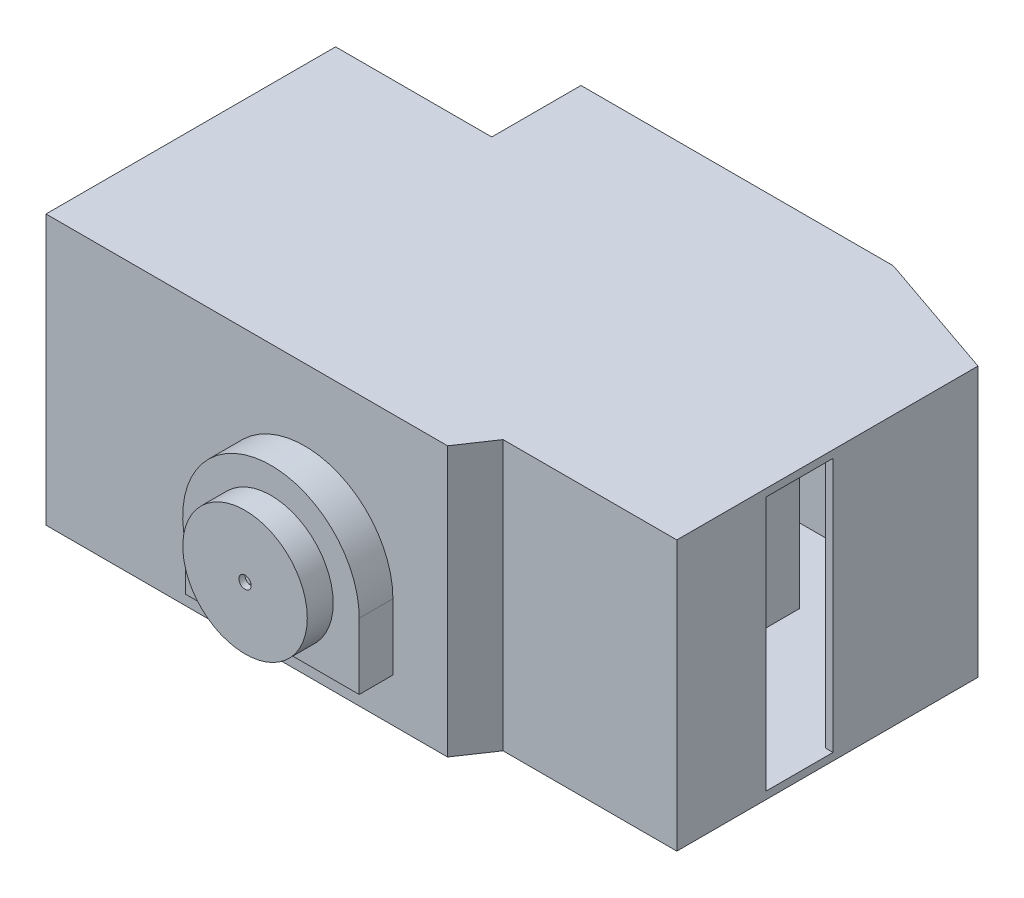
SolidWorks part; units mm, degrees
ref_plane "Front" through (0, 0, 0) normal (0, 0, 1) x (1, 0, 0)
ref_plane "Top" through (0, 0, 0) normal (0, 1, 0) x (1, 0, 0)
ref_plane "Right" through (0, 0, 0) normal (1, 0, 0) x (0, 0, -1)
sketch "Sketch1" plane through (0, 0, 0) normal (0, 1, 0) x (1, 0, 0)
  line L1 (101.6, 101.6) -> (101.6, 1524)
  line L2 (5486.4, 0) -> (5791.7752, 452.7374)
  line L3 (5791.7752, 452.7374) -> (8166.6752, 452.7374)
  line L4 (8166.6752, 452.7374) -> (8166.6752, 1671.9374)
  line L5 (8166.6752, 1671.9374) -> (8166.6752, 2586.3374) construction
  line L6 (8166.6752, 2586.3374) -> (8166.6752, 4567.5374)
  line L7 (8166.6752, 4567.5374) -> (6401.4866, 5175.3406)
  line L8 (6401.4866, 5175.3406) -> (5029.8866, 5175.3406)
  line L9 (5029.8866, 5175.3406) -> (3201.0866, 5175.3406) construction
  line L10 (3201.0866, 5175.3406) -> (2134.2866, 5175.3406)
  line L11 (2134.2866, 5175.3406) -> (2134.2866, 3956.1406)
  line L12 (2134.2866, 3956.1406) -> (0.6866, 3956.1406)
  line L13 (0.6866, 3956.1406) -> (0.6866, 2432.1406)
  line L14 (0, 0) -> (0, 1524)
  line L15 (0.6866, 2432.1406) -> (0, 1524) construction
  line L17 (5432.3783, 101.6) -> (5737.7536, 554.3374)
  line L18 (5737.7536, 554.3374) -> (6134.6752, 554.3374)
  line L19 (8065.0752, 554.3374) -> (8065.0752, 1671.9374)
  line L20 (3201.0866, 5073.7406) -> (2235.8866, 5073.7406)
  line L21 (2235.8866, 5073.7406) -> (2235.8866, 3854.5406)
  line L22 (2235.8866, 3854.5406) -> (102.2866, 3854.5406)
  line L23 (102.2866, 3854.5406) -> (102.2866, 2432.1406)
  line L24 (8065.0752, 2586.3374) -> (8065.0752, 4495.0668)
  line L25 (8065.0752, 4495.0668) -> (6384.4846, 5073.7406)
  line L26 (6384.4846, 5073.7406) -> (6236.2752, 5073.7406)
  line L27 (0.6866, 2432.1406) -> (102.2866, 2432.1406)
  line L28 (3201.0866, 5175.3406) -> (3201.0866, 5073.7406)
  line L29 (5029.8866, 5175.3406) -> (5029.8866, 5073.7406)
  line L30 (8166.6752, 2586.3374) -> (8065.0752, 2586.3374)
  line L31 (8166.6752, 1671.9374) -> (8065.0752, 1671.9374)
  line L32 (101.6, 1524) -> (0, 1524)
  line L33 (6236.2752, 554.3374) -> (6236.2752, 4059.5374)
  line L34 (6134.6752, 554.3374) -> (6134.6752, 4059.5374)
  line L35 (6236.2752, 4059.5374) -> (6134.6752, 4059.5374)
  line L36 (6236.2752, 554.3374) -> (8065.0752, 554.3374)
  line L37 (5737.7536, 554.3374) -> (8065.0752, 554.3374) construction
  line L38 (6236.2752, 4059.5374) -> (6236.2752, 4973.9374) construction
  line L39 (6236.2752, 4973.9374) -> (6236.2752, 5073.7406)
  line L40 (6134.6752, 4973.9374) -> (6134.6752, 5073.7406)
  line L41 (6134.6752, 4973.9374) -> (6236.2752, 4973.9374)
  line L42 (6134.6752, 5073.7406) -> (5029.8866, 5073.7406)
  line L43 (6384.4846, 5073.7406) -> (5029.8866, 5073.7406) construction
  line L46 (101.6, 101.6) -> (5432.3783, 101.6)
  line L47 (0, 0) -> (5486.4, 0)
  line L48 (101.6, 101.6) -> (5432.3783, 101.6) construction
  line L50 (0, 0) -> (5486.4, 0) construction
  dimension "D1" = 5486.4
  dimension "D3" = 2374.9
  dimension "D4" = 1219.2
  dimension "D5" = 914.4
  dimension "D6" = 1981.2
  dimension "D7" = 109
  dimension "D8" = 1866.9
  dimension "D9" = 1371.6
  dimension "D10" = 1828.8
  dimension "D11" = 1066.8
  dimension "D12" = 1219.2
  dimension "D13" = 2133.6
  dimension "D14" = 1524
  dimension "D15" = 1524
  dimension "D16" = 546.1
  dimension "D17" = 101.6
  dimension "D18" = 101.6
  dimension "D19" = 5330.7783
  dimension "D20" = 3505.2
  dimension "D21" = 1828.8
  dimension "D22" = 101.6
  dimension "D23" = 914.4
  dimension "D24" = 101.6
  dimension "D25" = 101.6
extrude "Extrude5" add sketch "Sketch1" along normal blind 3479.8
sketch "Sketch2" plane through (0, 3479.8, 0) normal (0, 1, 0) x (1, 0, 0)
  line L0 (0.6866, 3956.1406) -> (2134.2866, 3956.1406)
  line L1 (2134.2866, 3956.1406) -> (2134.2866, 5175.3406)
  line L2 (2134.2866, 5175.3406) -> (6401.4866, 5175.3406)
  line L3 (6401.4866, 5175.3406) -> (8166.6752, 4567.5374)
  line L4 (8166.6752, 4567.5374) -> (8166.6752, 452.7374)
  line L5 (8166.6752, 452.7374) -> (5791.7752, 452.7374)
  line L6 (5791.7752, 452.7374) -> (5486.4, 0)
  line L7 (5486.4, 0) -> (0, 0)
  line L8 (0, 0) -> (0.6866, 3956.1406)
extrude "Extrude6" add sketch "Sketch2" along normal blind 101.6
sketch "Sketch3" plane through (0, 0, 0) normal (0, -1, 0) x (1, 0, 0)
  line L2 (8166.6752, -452.7374) -> (5791.7752, -452.7374)
  line L3 (5791.7752, -452.7374) -> (5486.4, 0)
  line L4 (5486.4, 0) -> (0, 0)
  line L5 (0, 0) -> (0.6866, -3956.1406)
  line L6 (0.6866, -3956.1406) -> (2134.2866, -3956.1406)
  line L7 (2134.2866, -3956.1406) -> (2134.2866, -5175.3406)
  line L8 (2134.2866, -5175.3406) -> (6401.4866, -5175.3406)
  line L10 (6401.4866, -5175.3406) -> (8166.6752, -4567.5374)
  line L11 (8166.6752, -4567.5374) -> (8166.6752, -452.7374)
extrude "Extrude7" add sketch "Sketch3" along normal blind 101.6
sketch "Sketch4" plane through (0, 0, 0) normal (0, 0, 1) x (1, 0, 0)
  line L1 (3533.775, 2604.4) -> (2188.3802, 2604.4) construction
  line L3 (5486.4, -101.6) -> (0, -101.6) construction
  line L4 (0, 3479.8) -> (0, 0) construction
  line L5 (4739.775, 1398.4) -> (4739.775, 495.3)
  line L8 (2368.55, 495.3) -> (4739.775, 495.3)
  line L10 (2368.55, 1087.4552) -> (2368.55, 495.3)
  arc A2 (4739.775, 1398.4) -> (2368.55, 1087.4552) centre (3533.775, 1398.4) ccw
  dimension "D1" = 596.9
  dimension "D4" = 1500
  dimension "D6" = 1206
  dimension "D2" = 2368.55
  dimension "D3" = 3533.775
extrude "Extrude8" add sketch "Sketch4" along normal blind 460.0575
sketch "Sketch5" plane through (0, 0, 460.0575) normal (0, 0, 1) x (1, 0, 0)
  circle A0 centre (3533.775, 1398.4) radius 850.392
  dimension "D1" = 1700.784
extrude "Extrude9" add sketch "Sketch5" along normal blind 353.9998
sketch "Sketch6" plane through (0, 0, -101.6) normal (0, 0, -1) x (-1, 0, 0)
  line L0 (-4286.8089, 590.55) -> (-2780.7411, 590.55)
  line L1 (-5432.3783, 0) -> (-101.6, 0) construction
  arc A0 (-2368.55, 1087.4552) -> (-4739.775, 1398.4) centre (-3533.775, 1398.4) ccw construction
  arc A1 (-2368.55, 1087.4552) -> (-4739.775, 1398.4) centre (-3533.775, 1398.4) ccw construction
  arc A2 (-2780.7411, 590.55) -> (-4286.8089, 590.55) centre (-3533.775, 1398.4) ccw
  dimension "D1" = 2208.784
  dimension "D2" = 590.55
extrude "Extrude10" cut sketch "Sketch6" against normal blind 546.1
sketch "Sketch7" plane through (0, 0, 444.5) normal (0, 0, -1) x (-1, 0, 0)
  circle A1 centre (-3533.775, 1398.4) radius 748.792
  dimension "D1" = 1497.584
extrude "Extrude11" cut sketch "Sketch7" against normal blind 285.75
sketch "Sketch8" plane through (0, 0, 730.25) normal (0, 0, -1) x (-1, 0, 0)
  circle A0 centre (-3533.775, 1398.4) radius 84.1375
  dimension "D1" = 168.275
extrude "Extrude12" cut sketch "Sketch8" against normal through all
sketch "Sketch9" plane through (0, 0, 0) normal (0, 1, 0) x (1, 0, 0)
  line L0 (102.2866, 3854.5406) -> (2235.8866, 3854.5406) construction
  line L1 (5432.3783, 101.6) -> (101.6, 101.6) construction
  line L2 (102.2866, 3854.5406) -> (2235.8866, 3854.5406) construction
  line L3 (5432.3783, 101.6) -> (101.6, 101.6) construction
  line L4 (101.6, 101.6) -> (101.6, 1524) construction
  line L5 (1066.8, 101.6) -> (952.5, 101.6)
  line L6 (1066.8, 101.6) -> (1066.8, 3854.5406)
  line L7 (1066.8, 3854.5406) -> (952.5, 3854.5406)
  line L8 (952.5, 101.6) -> (952.5, 3854.5406)
  dimension "D1" = 850.9
  dimension "D2" = 965.2
extrude "Extrude13" add sketch "Sketch9" along normal up to surface (3479.8 mm away)
